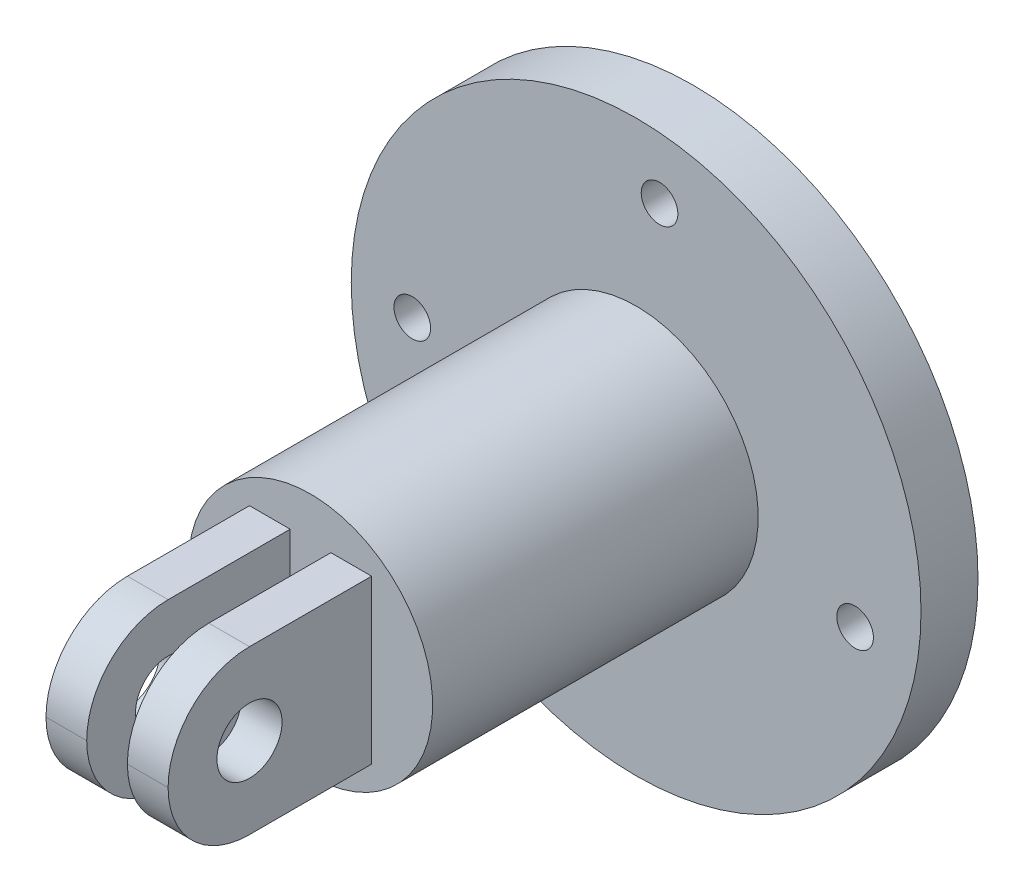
SolidWorks part; units mm, degrees
ref_plane "Plan de face" through (0, 0, 0) normal (0, 0, 1) x (1, 0, 0)
ref_plane "Plan de dessus" through (0, 0, 0) normal (0, 1, 0) x (1, 0, 0)
ref_plane "Plan de droite" through (0, 0, 0) normal (1, 0, 0) x (0, 0, -1)
sketch "Esquisse1" plane through (0, 0, 0) normal (0, 0, 1) x (1, 0, 0)
  line L1 (-7.5, 10) -> (-2.5, 10)
  line L2 (-7.5, 10) -> (-7.5, -10)
  line L3 (-7.5, -10) -> (-2.5, -10)
  line L4 (-2.5, 10) -> (-2.5, -10)
  line L5 (2.5, 10) -> (7.5, 10)
  line L6 (2.5, 10) -> (2.5, -10)
  line L7 (2.5, -10) -> (7.5, -10)
  line L8 (7.5, 10) -> (7.5, -10)
  dimension "D1" = 20
  dimension "D2" = 5
  dimension "D3" = 2.5
  dimension "D4" = 10
  dimension "D5" = 20
  dimension "D6" = 5
  dimension "D7" = 2.5
extrude "Boss.-Extru.1" add sketch "Esquisse1" along normal blind 25
sketch "Esquisse2" plane through (0, 0, 0) normal (0, 0, -1) x (-1, 0, 0)
  circle A0 centre (0, 0) radius 15
  dimension "D1" = 30
extrude "Boss.-Extru.2" add sketch "Esquisse2" along normal blind 40
fillet "Congé1" radius 10 4 edges at (5, -10, 25) (-5, -10, 25) (-5, 10, 25) (5, 10, 25)
sketch "Esquisse4" plane through (7.5, 0, 0) normal (1, 0, 0) x (0, 0, -1)
  circle A0 centre (-15, 0) radius 4
  arc A1 (-25, 0) -> (-15, -10) centre (-15, 0) ccw construction
  dimension "D1" = 8
extrude "Enlèv. mat.-Extru.2" cut sketch "Esquisse4" against normal blind 20 contours A0
sketch "Esquisse5" plane through (0, 0, -40) normal (0, 0, -1) x (-1, 0, 0)
  circle A0 centre (0, 0) radius 35
  dimension "D1" = 70
extrude "Boss.-Extru.3" add sketch "Esquisse5" along normal blind 7
sketch "Esquisse6" plane through (0, 0, -40) normal (0, 0, 1) x (1, 0, 0)
  circle A0 centre (-27.5, 0) radius 2.25
  circle A1 centre (0, 0) radius 35 construction
  dimension "D1" = 4.5
  dimension "D2" = 27.5
extrude "Enlèv. mat.-Extru.3" cut sketch "Esquisse6" against normal blind 7
pattern_circular "Répétition circulaire1" count 4 over 288 about axis through (0, 0, 0) along (0, 0, 1) of "Enlèv. mat.-Extru.3"
